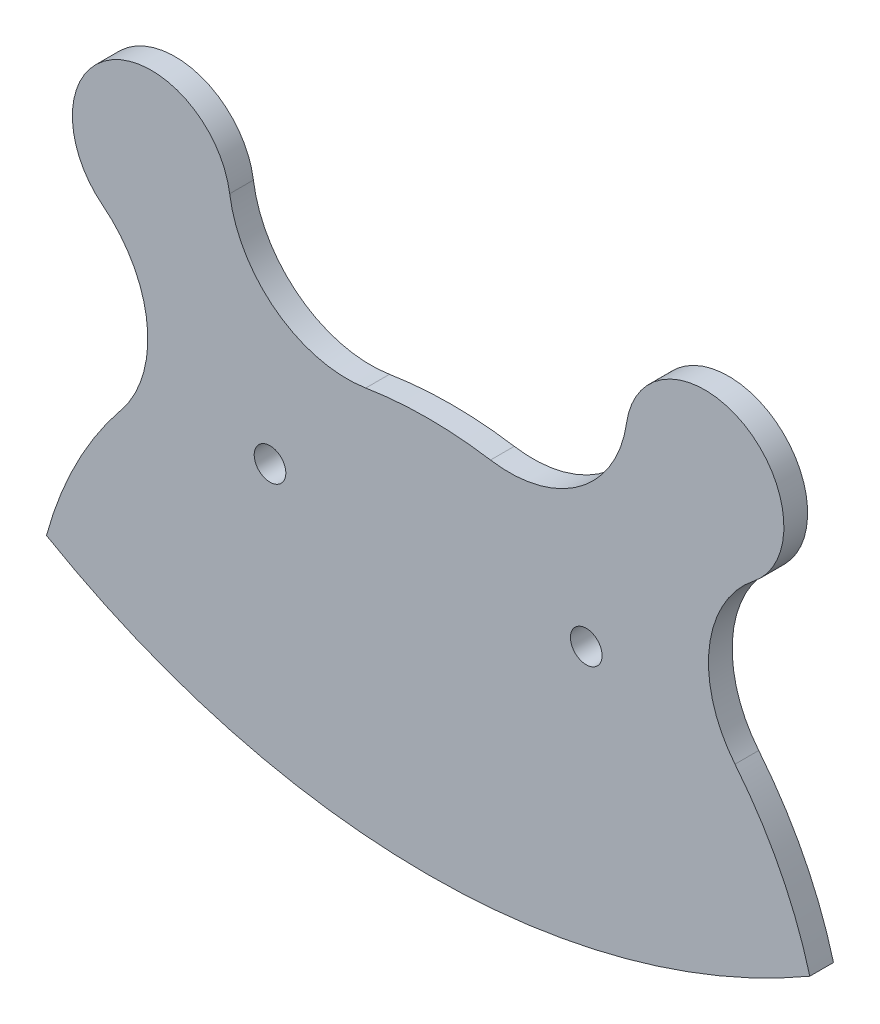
SolidWorks part; units mm, degrees
ref_plane "Front Plane" through (0, 0, 0) normal (0, 0, 1) x (1, 0, 0)
ref_plane "Top Plane" through (0, 0, 0) normal (0, 1, 0) x (1, 0, 0)
ref_plane "Right Plane" through (0, 0, 0) normal (1, 0, 0) x (0, 0, -1)
sketch "Sketch2" plane through (0, 0, 0) normal (0, 0, 1) x (1, 0, 0)
  line L0 (0, 0) -> (-50, 0) construction
  line L1 (0, -44.4763) -> (0, 96) construction
  line L3 (0, 0) -> (-35, 60.6218) construction
  line L4 (0, 0) -> (-50.4589, 40.9743) construction
  line L5 (0, 0) -> (-10.2554, 64.1859) construction
  arc A0 (7.8887, 49.3738) -> (-7.8887, 49.3738) centre (0, 0) ccw
  arc A1 (25.1021, 62.0474) -> (7.8887, 49.3738) centre (10.2554, 64.1859) cw
  arc A2 (-25.1021, 62.0474) -> (-41.1836, 52.7628) centre (-35, 60.6218) ccw
  arc A3 (-38.8146, 31.5187) -> (-41.1836, 52.7628) centre (-50.4589, 40.9743) ccw
  arc A4 (-25.1021, 62.0474) -> (-7.8887, 49.3738) centre (-10.2554, 64.1859) ccw
  arc A5 (-38.8146, 31.5187) -> (-48.2748, 13.0208) centre (0, 0) ccw
  arc A6 (0, 70) -> (-60.6218, 35) centre (0, 0) ccw construction
  arc A7 (-48.2748, 13.0208) -> (48.2748, 13.0208) centre (0, 96) ccw
  arc A8 (25.1021, 62.0474) -> (41.1836, 52.7628) centre (35, 60.6218) cw
  arc A9 (38.8146, 31.5187) -> (41.1836, 52.7628) centre (50.4589, 40.9743) cw
  arc A10 (38.8146, 31.5187) -> (48.2748, 13.0208) centre (0, 0) cw
  circle A11 centre (-20, 35) radius 2
  circle A12 centre (20, 35) radius 2
  arc A18 (0, 65) -> (-63.6279, 13.285) centre (0, 0) ccw construction
  dimension "D1" = 96
  dimension "D5" = 4
  dimension "D6" = 70
  dimension "D7" = 65
  dimension "D8" = 20
  dimension "D4" = 60
  dimension "D2" = 30
  dimension "D3" = 50
  dimension "D9" = 35
  dimension "D10" = 35
  dimension "D11" = 20
  dimension "D12" = 20
extrude "Extrude1" add sketch "Sketch2" along normal blind 3
